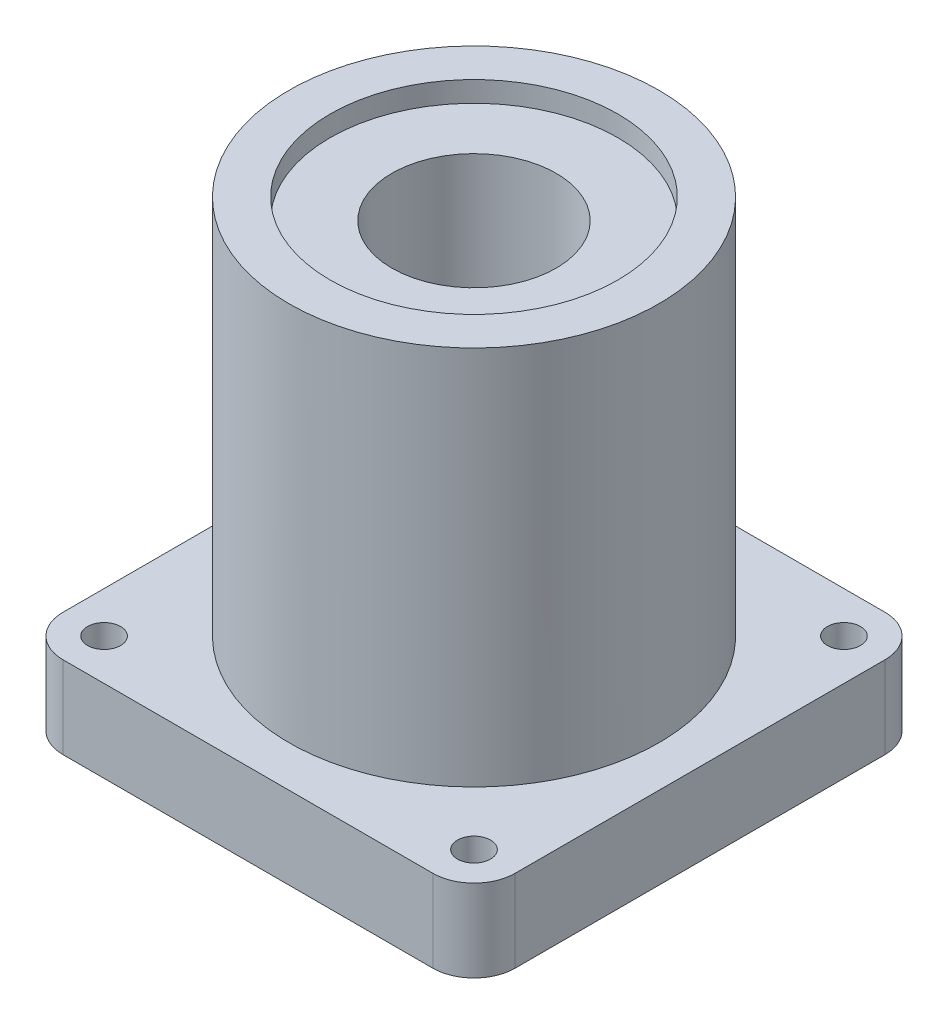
SolidWorks part; units mm, degrees
ref_plane "front" through (0, 0, 0) normal (0, 0, 1) x (1, 0, 0)
ref_plane "top" through (0, 0, 0) normal (0, 1, 0) x (1, 0, 0)
ref_plane "side" through (0, 0, 0) normal (1, 0, 0) x (0, 0, -1)
sketch "Sketch1" plane through (0, 0, 0) normal (0, 1, 0) x (1, 0, 0)
  line L0 (-34.925, -34.925) -> (34.925, -34.925)
  line L1 (-34.925, -34.925) -> (-34.925, 34.925)
  line L2 (34.925, 34.925) -> (-34.925, 34.925)
  line L3 (34.925, 34.925) -> (34.925, -34.925)
  line L4 (34.925, 0) -> (0, 0) construction
  line L5 (0, -34.925) -> (0, 0) construction
  dimension "D1" = 69.85
extrude "Base-Extrude" add sketch "Sketch1" along normal blind 12.7
sketch "Sketch2" plane through (0, 0, 0) normal (0, 1, 0) x (-1, 0, 0)
  circle A0 centre (0, 0) radius 28.575
  dimension "D1" = 57.15
extrude "Boss-Extrude1" add sketch "Sketch2" along normal blind 71.4375
sketch "Sketch3" plane through (0, 71.4375, 0) normal (0, 1, 0) x (-1, 0, 0)
  circle A0 centre (0, 0) radius 12.7
  dimension "D1" = 25.4
extrude "Cut-Extrude1" cut sketch "Sketch3" against normal through all
sketch "Sketch4" plane through (0, 71.4375, 0) normal (0, 1, 0) x (-1, 0, 0)
  circle A0 centre (0, 0) radius 22.225
  dimension "D1" = 44.45
extrude "Cut-Extrude2" cut sketch "Sketch4" against normal blind 3.175
fillet "Fillet1" radius 6.35 4 edges at (-34.925, 6.35, 34.925) (34.925, 6.35, 34.925) (34.925, 6.35, -34.925) (-34.925, 6.35, -34.925)
hole_wizard "1/4-20 Tapped Hole2" positions "Sketch8" profile "Sketch7" tap size "1/4-20" standard "Ansi Inch"
sketch "Sketch8" plane through (0, 12.7, 0) normal (0, 1, 0) x (-1, 0, 0)
  arc A0 (28.575, -34.925) -> (34.925, -28.575) centre (28.575, -28.575) ccw construction
  point P0 (28.575, -28.575)
sketch "Sketch7" plane through (-28.575, 12.7, -28.575) normal (1, 0, 0) x (0, 0, 1)
  line L0 (0, 0) -> (0, 20.5838)
  line L1 (0, 20.5838) -> (2.5527, 19.05)
  line L2 (2.5527, 19.05) -> (2.5527, 0)
  line L5 (2.5527, 0) -> (0, 0)
  line L10 (0, 20.5838) -> (-2.5527, 19.05) construction
  line L11 (0, -6.35) -> (0, 107.95) construction
  dimension "Hole Dia." = 5.1054
  dimension "Hole Depth" = 19.05
  dimension "Drill Angle" = 118
pattern_circular "CirPattern2" count 4 over 360 about axis through (0, 0, 0) along (0, 1, 0) of "1/4-20 Tapped Hole2"
